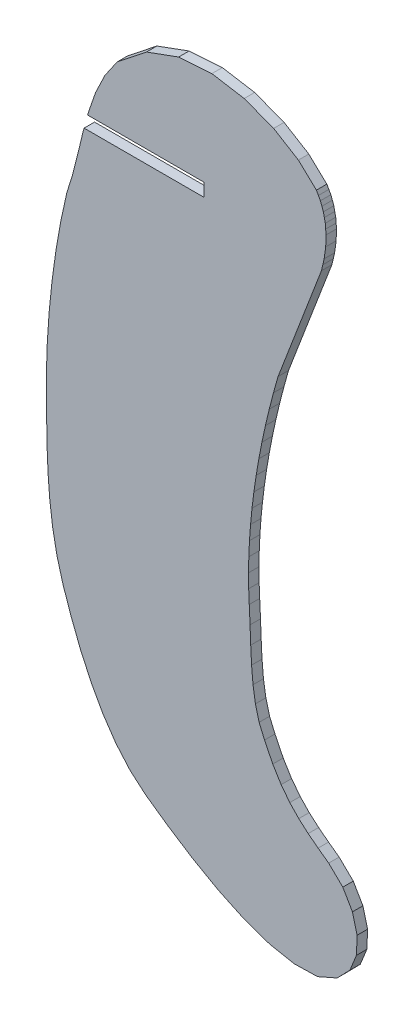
SolidWorks part; units mm, degrees
ref_plane "Спереди" through (0, 0, 0) normal (0, 0, 1) x (1, 0, 0)
ref_plane "Сверху" through (0, 0, 0) normal (0, 1, 0) x (1, 0, 0)
ref_plane "Справа" through (0, 0, 0) normal (1, 0, 0) x (0, 0, -1)
sketch "Model" plane through (0, 0, 0) normal (0, 0, 1) x (1, 0, 0)
  line L0 (-5212.5913, 37.1104) -> (-5212.5403, 39.7904)
  line L1 (-5212.5403, 39.7904) -> (-5212.4114, 42.526)
  line L2 (-5212.4114, 42.526) -> (-5212.2056, 45.313)
  line L3 (-5212.2056, 45.313) -> (-5211.9238, 48.1474)
  line L4 (-5211.9238, 48.1474) -> (-5211.5671, 51.0252)
  line L5 (-5211.5671, 51.0252) -> (-5211.1279, 53.9987)
  line L6 (-5211.1279, 53.9987) -> (-5210.613, 57.0087)
  line L7 (-5210.613, 57.0087) -> (-5210.0239, 60.0509)
  line L8 (-5210.0239, 60.0509) -> (-5209.3618, 63.1208)
  line L9 (-5209.3618, 63.1208) -> (-5208.6274, 66.2141)
  line L10 (-5208.6274, 66.2141) -> (-5207.822, 69.3265)
  line L11 (-5207.822, 69.3265) -> (-5206.9468, 72.4538)
  line L12 (-5206.9468, 72.4538) -> (-5198.6333, 94.1661)
  line L13 (-5198.6333, 94.1661) -> (-5198.3743, 95.2826)
  line L14 (-5198.3743, 95.2826) -> (-5198.1152, 96.399)
  line L15 (-5198.1152, 96.399) -> (-5197.8245, 98.5256)
  line L16 (-5197.8245, 98.5256) -> (-5197.7559, 100.5307)
  line L17 (-5197.7559, 100.5307) -> (-5197.8303, 101.4649)
  line L18 (-5197.8303, 101.4649) -> (-5197.9048, 102.3991)
  line L19 (-5197.9048, 102.3991) -> (-5198.0854, 103.2575)
  line L20 (-5198.0854, 103.2575) -> (-5198.2659, 104.1157)
  line L21 (-5198.2659, 104.1157) -> (-5198.5503, 104.8904)
  line L22 (-5198.5503, 104.8904) -> (-5198.8345, 105.665)
  line L23 (-5198.8345, 105.665) -> (-5199.22, 106.3485)
  line L24 (-5199.22, 106.3485) -> (-5199.6055, 107.0321)
  line L25 (-5199.6055, 107.0321) -> (-5203.0583, 110.2957)
  line L26 (-5203.0583, 110.2957) -> (-5207.7881, 113.1763)
  line L27 (-5207.7881, 113.1763) -> (-5213.428, 115.3137)
  line L28 (-5213.428, 115.3137) -> (-5219.6101, 116.347)
  line L29 (-5219.6101, 116.347) -> (-5225.9675, 115.916)
  line L30 (-5225.9675, 115.916) -> (-5232.1323, 113.66)
  line L31 (-5232.1323, 113.66) -> (-5237.7378, 109.2189)
  line L32 (-5237.7378, 109.2189) -> (-5240.0732, 105.8245)
  line L33 (-5240.0732, 105.8245) -> (-5241.8538, 102.1048)
  line L34 (-5241.8538, 102.1048) -> (-5243.2202, 98.1782)
  line L35 (-5243.2202, 98.1782) -> (-5243.3812, 97.5868)
  line L36 (-5243.3812, 97.5868) -> (-5221.0781, 97.5868)
  line L37 (-5221.0781, 97.5868) -> (-5221.0781, 97.3368)
  line L38 (-5221.0781, 97.3368) -> (-5221.0781, 95.3368)
  line L39 (-5221.0781, 95.3368) -> (-5221.0781, 95.0868)
  line L40 (-5221.0781, 95.0868) -> (-5244.0614, 95.0868)
  line L41 (-5244.0614, 95.0868) -> (-5244.313, 94.1625)
  line L42 (-5244.313, 94.1625) -> (-5245.2729, 90.176)
  line L43 (-5245.2729, 90.176) -> (-5246.2405, 86.3367)
  line L44 (-5246.2405, 86.3367) -> (-5247.3562, 82.7632)
  line L45 (-5247.3562, 82.7632) -> (-5248.4905, 77.5845)
  line L46 (-5248.4905, 77.5845) -> (-5249.4329, 72.2315)
  line L47 (-5249.4329, 72.2315) -> (-5250.1833, 66.8022)
  line L48 (-5250.1833, 66.8022) -> (-5250.7407, 61.3944)
  line L49 (-5250.7407, 61.3944) -> (-5251.1047, 56.1062)
  line L50 (-5251.1047, 56.1062) -> (-5251.2749, 51.0358)
  line L51 (-5251.2749, 51.0358) -> (-5251.2505, 46.2813)
  line L52 (-5251.2505, 46.2813) -> (-5251.2139, 42.4921)
  line L53 (-5251.2139, 42.4921) -> (-5251.1353, 38.507)
  line L54 (-5251.1353, 38.507) -> (-5250.9575, 34.3789)
  line L55 (-5250.9575, 34.3789) -> (-5250.6238, 30.161)
  line L56 (-5250.6238, 30.161) -> (-5250.0776, 25.9063)
  line L57 (-5250.0776, 25.9063) -> (-5249.2622, 21.6681)
  line L58 (-5249.2622, 21.6681) -> (-5248.1204, 17.4995)
  line L59 (-5248.1204, 17.4995) -> (-5246.4785, 12.7133)
  line L60 (-5246.4785, 12.7133) -> (-5244.6631, 8.1146)
  line L61 (-5244.6631, 8.1146) -> (-5242.6545, 3.7762)
  line L62 (-5242.6545, 3.7762) -> (-5240.4336, -0.2296)
  line L63 (-5240.4336, -0.2296) -> (-5237.9807, -3.8301)
  line L64 (-5237.9807, -3.8301) -> (-5235.2766, -6.9524)
  line L65 (-5235.2766, -6.9524) -> (-5232.3015, -9.5242)
  line L66 (-5232.3015, -9.5242) -> (-5227.9434, -12.59)
  line L67 (-5227.9434, -12.59) -> (-5223.2627, -15.6016)
  line L68 (-5223.2627, -15.6016) -> (-5218.3845, -18.3698)
  line L69 (-5218.3845, -18.3698) -> (-5213.4329, -20.7051)
  line L70 (-5213.4329, -20.7051) -> (-5208.5322, -22.418)
  line L71 (-5208.5322, -22.418) -> (-5203.8069, -23.3193)
  line L72 (-5203.8069, -23.3193) -> (-5199.3816, -23.2194)
  line L73 (-5199.3816, -23.2194) -> (-5195.6477, -21.5771)
  line L74 (-5195.6477, -21.5771) -> (-5193.196, -19.0669)
  line L75 (-5193.196, -19.0669) -> (-5191.9434, -15.9698)
  line L76 (-5191.9434, -15.9698) -> (-5191.8064, -12.5666)
  line L77 (-5191.8064, -12.5666) -> (-5192.7021, -9.1386)
  line L78 (-5192.7021, -9.1386) -> (-5194.5474, -5.9669)
  line L79 (-5194.5474, -5.9669) -> (-5197.2588, -3.3324)
  line L80 (-5197.2588, -3.3324) -> (-5199.2734, -1.8616)
  line L81 (-5199.2734, -1.8616) -> (-5201.1733, -0.3996)
  line L82 (-5201.1733, -0.3996) -> (-5202.9746, 1.172)
  line L83 (-5202.9746, 1.172) -> (-5204.6943, 2.9716)
  line L84 (-5204.6943, 2.9716) -> (-5206.3486, 5.1179)
  line L85 (-5206.3486, 5.1179) -> (-5207.9541, 7.7291)
  line L86 (-5207.9541, 7.7291) -> (-5209.5278, 10.924)
  line L87 (-5209.5278, 10.924) -> (-5210.5632, 13.3464)
  line L88 (-5210.5632, 13.3464) -> (-5211.2747, 16.0529)
  line L89 (-5211.2747, 16.0529) -> (-5211.7334, 18.9888)
  line L90 (-5211.7334, 18.9888) -> (-5212.0098, 22.0994)
  line L91 (-5212.0098, 22.0994) -> (-5212.175, 25.3301)
  line L92 (-5212.175, 25.3301) -> (-5212.2998, 28.6264)
  line L93 (-5212.2998, 28.6264) -> (-5212.4551, 31.9335)
  line L94 (-5212.4551, 31.9335) -> (-5212.5632, 34.4901)
  line L95 (-5212.5632, 34.4901) -> (-5212.5913, 37.1104)
extrude "Бобышка-Вытянуть1" add sketch "Model" along normal blind 2
